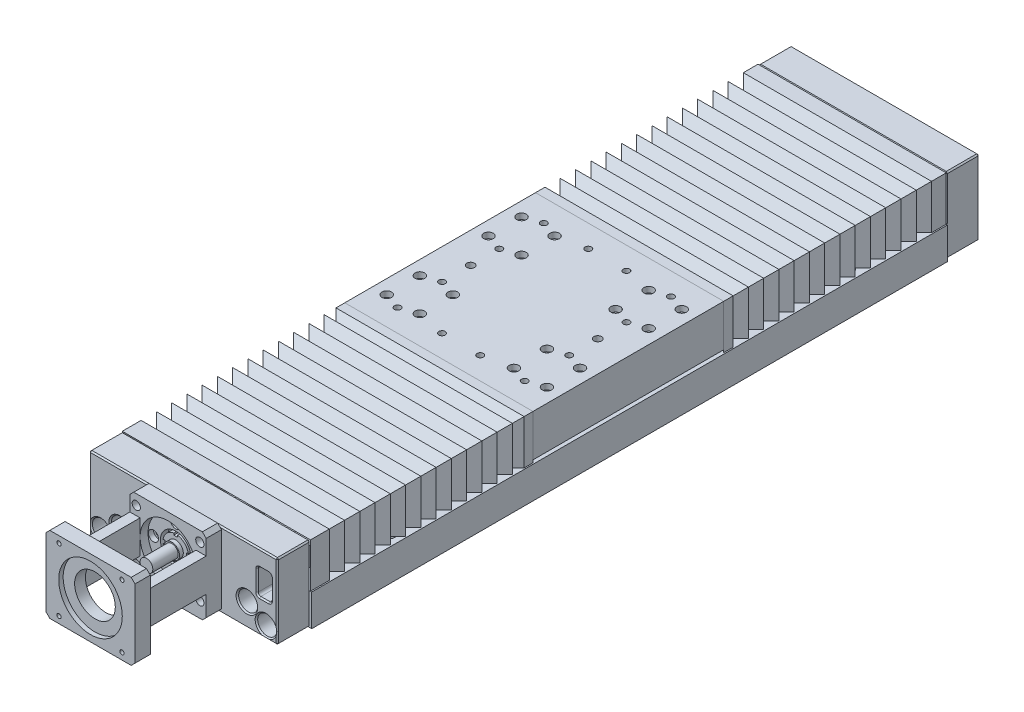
SolidWorks part; units mm, degrees
other "<AR15MN滑块>-<Ø5.0 (5) 直径孔1>" parameters "D14"=4, "D15"=4, "D23"=10, "D24"=7
ref_plane "前视基准面" through (0, 0, 0) normal (0, 0, 1) x (1, 0, 0)
ref_plane "上视基准面" through (0, 0, 0) normal (0, 1, 0) x (1, 0, 0)
ref_plane "右视基准面" through (0, 0, 0) normal (1, 0, 0) x (0, 0, -1)
sketch "草图1" plane through (0, 0, 0) normal (0, 0, 1) x (1, 0, 0)
  line L0 (37.5, 30) -> (42.5, 30)
  line L1 (-75, 0) -> (75, 0)
  line L2 (-75, 0) -> (-75, 25)
  line L3 (-42.5, 30) -> (-37.5, 30)
  line L4 (75, 0) -> (75, 25)
  line L6 (-37.5, 30) -> (-37.5, 16)
  line L7 (-34.5, 13) -> (34.5, 13)
  line L8 (37.5, 30) -> (37.5, 16)
  line L10 (-42.5, 30) -> (-42.5, 28)
  line L11 (-42.5, 28) -> (-45.5, 28)
  line L12 (42.5, 30) -> (42.5, 28)
  line L13 (42.5, 28) -> (45.5, 28)
  line L14 (-45.5, 28) -> (-45.5, 25)
  line L15 (-45.5, 25) -> (-75, 25)
  line L18 (45.5, 28) -> (45.5, 25)
  line L19 (45.5, 25) -> (75, 25)
  arc A0 (37.5, 16) -> (34.5, 13) centre (34.5, 16) cw
  arc A1 (-37.5, 16) -> (-34.5, 13) centre (-34.5, 16) ccw
  point P0 (-75, 0)
  point P3 (75, 0)
  point P12 (37.5, 13)
  point P22 (-37.5, 13)
  dimension "D11" = 3
  dimension "D1" = 150
  dimension "D2" = 13
  dimension "D3" = 75
  dimension "D4" = 85
  dimension "D5" = 91
  dimension "D6" = 30
  dimension "D7" = 75
  dimension "D9" = 25
  dimension "D10" = 28
extrude "凸台-拉伸1" add sketch "草图1" along normal mid plane 500
ref_plane "基准面1" through (0, 0, 250) normal (0, 0, 1) x (1, 0, 0)
sketch "草图3" plane through (0, 0, 250) normal (0, 0, 1) x (1, 0, 0)
  line L1 (-74, 60) -> (74, 60)
  line L2 (-74, 60) -> (-74, 1)
  line L3 (-74, 1) -> (74, 1)
  line L4 (74, 60) -> (74, 1)
  dimension "D1" = 148
  dimension "D2" = 59
  dimension "D3" = 74
  dimension "D4" = 1
extrude "凸台-拉伸2" add sketch "草图3" along normal blind 26 separate body
ref_plane "基准面2" through (0, 0, -250) normal (0, 0, -1) x (-1, 0, 0)
sketch "草图4" plane through (0, 0, -250) normal (0, 0, -1) x (-1, 0, 0)
  line L1 (-74, 1) -> (74, 1)
  line L2 (-74, 1) -> (-74, 60)
  line L3 (-74, 60) -> (74, 60)
  line L4 (74, 1) -> (74, 60)
extrude "凸台-拉伸3" add sketch "草图4" along normal blind 26
sketch "草图5" plane through (0, 0, 276) normal (0, 0, 1) x (1, 0, 0)
  circle A0 centre (0, 33) radius 10
  dimension "D1" = 20
  dimension "D2" = 33
extrude "切除-拉伸1" cut sketch "草图5" against normal up to next
sketch "草图6" plane through (0, 0, 276) normal (0, 0, 1) x (1, 0, 0)
  circle A0 centre (0, 33) radius 14
  dimension "D1" = 28
extrude "切除-拉伸2" cut sketch "草图6" against normal blind 18
sketch "草图7" plane through (0, 0, -276) normal (0, 0, -1) x (-1, 0, 0)
  circle A0 centre (0, 33) radius 13
  dimension "D2" = 26
  dimension "D1" = 33
extrude "切除-拉伸3" cut sketch "草图7" against normal up to next
sketch "草图8" plane through (0, 0, 0) normal (0, 0, 1) x (1, 0, 0)
  line L0 (-20, 44) -> (-20, 24)
  line L1 (-74, 60) -> (74, 60)
  line L2 (-74, 60) -> (-74, 27)
  line L3 (-10, 14) -> (10, 14)
  line L4 (74, 60) -> (74, 27)
  line L5 (-20, 44) -> (-33, 44)
  line L6 (20, 44) -> (20, 33)
  line L7 (-33, 44) -> (-33, 52)
  line L8 (-33, 52) -> (-67, 52)
  line L9 (-67, 52) -> (-67, 44)
  line L10 (-67, 44) -> (-69, 44)
  line L11 (-69, 44) -> (-69, 27)
  line L12 (20, 33) -> (17, 33)
  line L13 (-69, 27) -> (-74, 27)
  line L14 (20, 44) -> (33, 44)
  line L15 (17, 33) -> (17, 21)
  line L16 (33, 44) -> (33, 52)
  line L17 (33, 52) -> (67, 52)
  line L18 (67, 52) -> (67, 44)
  line L19 (67, 44) -> (69, 44)
  line L20 (69, 44) -> (69, 27)
  line L21 (69, 27) -> (74, 27)
  line L22 (-20, 24) -> (-10, 14)
  line L23 (10, 14) -> (17, 21)
  circle A0 centre (0, 33) radius 10
  point P9 (-20, 14)
  point P12 (17, 14)
  dimension "D1" = 20
  dimension "D2" = 27
  dimension "D3" = 148
  dimension "D4" = 74
  dimension "D5" = 33
  dimension "D6" = 40
  dimension "D7" = 20
  dimension "D8" = 46
  dimension "D9" = 3
  dimension "D10" = 138
  dimension "D11" = 69
  dimension "D12" = 33
  dimension "D13" = 66
  dimension "D14" = 33
  dimension "D15" = 34
  dimension "D16" = 34
  dimension "D17" = 8
  dimension "D18" = 16
  dimension "D19" = 16
  dimension "D20" = 27
extrude "凸台-拉伸4" add sketch "草图8" along normal mid plane 150 separate body
sketch "草图9" plane through (0, 0, -75) normal (0, 0, -1) x (-1, 0, 0)
  line L1 (-33, 44) -> (30.2224, 44)
  line L2 (-33, 44) -> (-33, 7.4314)
  line L3 (-33, 7.4314) -> (30.2224, 7.4314)
  line L4 (30.2224, 44) -> (30.2224, 7.4314)
extrude "切除-拉伸4" cut sketch "草图9" against normal blind 60
sketch "草图10" plane through (0, 0, 75) normal (0, 0, 1) x (1, 0, 0)
  circle A0 centre (0, 33) radius 14
  dimension "D1" = 28
extrude "切除-拉伸5" cut sketch "草图10" against normal blind 50
hole_wizard "M6 螺纹孔1" positions "草图12" profile "草图11" tap size "M6" standard "GB"
sketch "草图12" plane through (0, 60, 0) normal (0, 1, 0) x (-1, 0, 0)
  point P0 (50, -57.5)
  point P1 (15, -57.5)
  point P3 (-15, -57.5)
  point P5 (-50, -57.5)
  point P7 (50, -22.5)
  point P9 (50, 22.5)
  point P11 (50, 57.5)
  point P17 (15, 57.5)
  point P23 (-15, 57.5)
  point P25 (-50, -22.5)
  point P27 (-50, 22.5)
  point P29 (-50, 57.5)
  dimension "D1" = 45
  dimension "D2" = 35
  dimension "D3" = 35
  dimension "D4" = 22.5
  dimension "D5" = 30
  dimension "D6" = 35
  dimension "D7" = 35
  dimension "D8" = 15
sketch "草图11" plane through (-50, 60, -57.5) normal (1, 0, 0) x (0, 0, 1)
  line L0 (0, 0) -> (0, 12.5022)
  line L1 (0, 12.5022) -> (2.5, 11)
  line L2 (2.5, 11) -> (2.5, 0)
  line L5 (2.5, 0) -> (0, 0)
  line L10 (0, 12.5022) -> (-2.5, 11) construction
  line L11 (0, -6.35) -> (0, 107.95) construction
  dimension "螺纹孔钻头直径" = 5
  dimension "螺纹孔钻头深度" = 11
  dimension "导头角度" = 118
hole_wizard "孔1" positions "草图15" profile "草图14" legacy
sketch "草图15" plane through (0, 60, 0) normal (0, 1, 0) x (-1, 0, 0)
  point P0 (-63, -53)
  point P1 (-63, -27)
  point P3 (-37, -53)
  point P5 (-37, -27)
  point P7 (-63, 27)
  point P9 (-63, 53)
  point P11 (-37, 27)
  point P13 (-37, 53)
  point P15 (63, 53)
  point P17 (63, 27)
  point P19 (37, 27)
  point P21 (37, 53)
  point P23 (63, -27)
  point P25 (63, -53)
  point P27 (37, -53)
  point P29 (37, -27)
  dimension "D1" = 26
  dimension "D2" = 26
  dimension "D3" = 26
  dimension "D4" = 26
  dimension "D5" = 54
  dimension "D6" = 27
  dimension "D7" = 74
  dimension "D8" = 37
sketch "草图14" plane through (63, 60, -53) normal (1, 0, 0) x (0, 0, 1)
  line L0 (0, 0) -> (0, 100)
  line L1 (0, 100) -> (2.25, 100)
  line L2 (2.25, 100) -> (2.25, 4.5)
  line L3 (2.25, 4.5) -> (3.75, 4.5)
  line L4 (3.75, 4.5) -> (3.75, 0)
  line L5 (3.75, 0) -> (0, 0)
  line L6 (0, 110) -> (0, -10) construction
  dimension "直径" = 4.5
  dimension "深度" = 100
  dimension "柱坑直径" = 7.5
  dimension "柱坑深度" = 4.5
ref_plane "基准面3" through (0, 33, 0) normal (0, 1, 0) x (-1, 0, 0)
sketch "草图17" plane through (0, 0, 276) normal (0, 0, 1) x (1, 0, 0)
  line L0 (58, 37) -> (69, 37) construction
  line L1 (60, 47) -> (67, 47)
  line L2 (58, 45) -> (58, 29)
  line L3 (60, 27) -> (67, 27)
  line L4 (69, 45) -> (69, 29)
  line L5 (-74, 1) -> (74, 1) construction
  line L6 (63.5, 47) -> (63.5, 27) construction
  arc A0 (69, 29) -> (67, 27) centre (67, 29) cw
  arc A1 (60, 27) -> (58, 29) centre (60, 29) cw
  arc A2 (58, 45) -> (60, 47) centre (60, 45) cw
  arc A3 (67, 47) -> (69, 45) centre (67, 45) cw
  point P14 (69, 27)
  point P17 (58, 27)
  point P22 (69, 47)
  dimension "D5" = 2
  dimension "D1" = 11
  dimension "D2" = 20
  dimension "D3" = 36
  dimension "D4" = 63.5
extrude "切除-拉伸6" cut sketch "草图17" against normal up to next
sketch "草图18" plane through (0, 0, 250) normal (0, 0, -1) x (-1, 0, 0)
  line L0 (-74, 1) -> (-74, 60) construction
  line L1 (-67, 47) -> (-34.5, 47)
  line L2 (-69, 45) -> (-69, 29)
  line L3 (-67, 27) -> (-34.5, 27)
  line L4 (-32.5, 45) -> (-32.5, 29)
  line L5 (-74, 60) -> (74, 60) construction
  arc A0 (-67, 27) -> (-69, 29) centre (-67, 29) cw
  arc A1 (-67, 47) -> (-69, 45) centre (-67, 45) ccw
  arc A2 (-34.5, 27) -> (-32.5, 29) centre (-34.5, 29) ccw
  arc A3 (-32.5, 45) -> (-34.5, 47) centre (-34.5, 45) ccw
  point P10 (-69, 27)
  point P13 (-69, 47)
  point P18 (-32.5, 47)
  dimension "D5" = 2
  dimension "D6" = 2
  dimension "D1" = 20
  dimension "D2" = 5
  dimension "D3" = 13
  dimension "D4" = 36.5
extrude "切除-拉伸7" cut sketch "草图18" against normal blind 10
hole_wizard "M6 螺纹孔2" positions "草图20" profile "草图19" tap size "M6" standard "GB"
sketch "草图20" plane through (0, 0, 276) normal (0, 0, 1) x (1, 0, 0)
  line L0 (-74, 1) -> (74, 1) construction
  point P0 (-25, 53)
  point P1 (25, 53)
  point P3 (-25, 13)
  point P5 (25, 13)
  dimension "D1" = 40
  dimension "D2" = 50
  dimension "D3" = 25
  dimension "D4" = 52
sketch "草图19" plane through (-25, 53, 276) normal (1, 0, 0) x (0, -1, 0)
  line L0 (0, 0) -> (0, 16.5022)
  line L1 (0, 16.5022) -> (2.5, 15)
  line L2 (2.5, 15) -> (2.5, 0)
  line L5 (2.5, 0) -> (0, 0)
  line L10 (0, 16.5022) -> (-2.5, 15) construction
  line L11 (0, -6.35) -> (0, 107.95) construction
  dimension "螺纹孔钻头直径" = 5
  dimension "螺纹孔钻头深度" = 15
  dimension "导头角度" = 118
chamfer "倒角1" distance 1 angle 45 12 edges at (0, 1, 250) (74, 30.5, 250) (74, 1, 263) (0, 1, 276) (74, 30.5, 276) (74, 60, 263) (0, 60, 250) (-74, 1, 263) (-74, 30.5, 250) (-74, 30.5, 276) (-74, 60, 263) (0, 60, 276)
hole_wizard "孔2" positions "草图23" profile "草图22" legacy
sketch "草图23" plane through (0, 0, 276) normal (0, 0, 1) x (1, 0, 0)
  line L0 (73, 1) -> (-73, 1) construction
  point P0 (-65, 10)
  point P1 (-50, 19)
  point P3 (50, 19)
  point P5 (65, 10)
  dimension "D1" = 130
  dimension "D2" = 65
  dimension "D3" = 100
  dimension "D4" = 50
  dimension "D5" = 9
  dimension "D6" = 18
sketch "草图22" plane through (-65, 10, 276) normal (1, 0, 0) x (0, -1, 0)
  line L0 (0, 0) -> (0, 100)
  line L1 (0, 100) -> (4.5, 100)
  line L2 (4.5, 100) -> (4.5, 16)
  line L3 (4.5, 16) -> (7.5, 16)
  line L4 (7.5, 16) -> (7.5, 0)
  line L5 (7.5, 0) -> (0, 0)
  line L6 (0, 110) -> (0, -10) construction
  dimension "直径" = 9
  dimension "深度" = 100
  dimension "柱坑直径" = 15
  dimension "柱坑深度" = 16
hole_wizard "孔3" positions "草图26" profile "草图25" legacy
sketch "草图26" plane through (0, 0, -276) normal (0, 0, -1) x (-1, 0, 0)
  line L0 (-74, 1) -> (74, 1) construction
  point P0 (-65, 10)
  point P1 (-50, 19)
  point P3 (65, 10)
  point P5 (50, 19)
  dimension "D1" = 100
  dimension "D2" = 130
  dimension "D3" = 50
  dimension "D4" = 65
  dimension "D5" = 9
  dimension "D6" = 18
sketch "草图25" plane through (65, 10, -276) normal (1, 0, 0) x (0, 1, 0)
  line L0 (0, 0) -> (0, 100)
  line L1 (0, 100) -> (4.5, 100)
  line L2 (4.5, 100) -> (4.5, 16)
  line L3 (4.5, 16) -> (7.5, 16)
  line L4 (7.5, 16) -> (7.5, 0)
  line L5 (7.5, 0) -> (0, 0)
  line L6 (0, 110) -> (0, -10) construction
  dimension "直径" = 9
  dimension "深度" = 100
  dimension "柱坑直径" = 15
  dimension "柱坑深度" = 16
sketch "草图28" plane through (0, 0, 276) normal (0, 0, 1) x (1, 0, 0)
  line L0 (82.5, 33) -> (-82.5, 33) construction
  line L1 (-30, 61) -> (30, 61)
  line L2 (-30, 61) -> (-30, 1)
  line L3 (-30, 1) -> (30, 1)
  line L4 (30, 61) -> (30, 1)
  circle A0 centre (0, 33) radius 22
  circle A1 centre (-25, 53) radius 3.25
  circle A2 centre (25, 53) radius 3.25
  circle A3 centre (25, 13) radius 3.25
  circle A4 centre (-25, 13) radius 3.25
  dimension "D5" = 44
  dimension "D6" = 6.5
  dimension "D1" = 60
  dimension "D2" = 60
  dimension "D3" = 28
  dimension "D4" = 30
extrude "凸台-拉伸5" add sketch "草图28" along normal blind 12
sketch "草图29" plane through (0, 0, 288) normal (0, 0, 1) x (1, 0, 0)
  line L0 (-30, 59) -> (-30, 2) construction
  line L1 (-30, 46) -> (-22, 46)
  line L2 (-30, 46) -> (-30, 20)
  line L3 (-30, 20) -> (-22, 20)
  line L4 (-22, 46) -> (-22, 20)
  line L5 (30, 1) -> (30, 61) construction
  line L6 (30, 46) -> (22, 46)
  line L7 (30, 46) -> (30, 20)
  line L8 (30, 20) -> (22, 20)
  line L9 (22, 46) -> (22, 20)
  line L10 (82.5, 33) -> (-82.5, 33) construction
  dimension "D1" = 26
  dimension "D2" = 13
  dimension "D3" = 8
  dimension "D4" = 8
extrude "凸台-拉伸6" add sketch "草图29" along normal blind 49
sketch "草图30" plane through (0, 0, 337) normal (0, 0, 1) x (1, 0, 0)
  line L0 (82.5, 33) -> (-82.5, 33) construction
  line L1 (-35, 63) -> (35, 63)
  line L2 (-35, 63) -> (-35, 3)
  line L3 (-35, 3) -> (35, 3)
  line L4 (35, 63) -> (35, 3)
  circle A0 centre (0, 33) radius 16
  dimension "D5" = 32
  dimension "D1" = 60
  dimension "D2" = 30
  dimension "D3" = 70
  dimension "D4" = 35
extrude "凸台-拉伸7" add sketch "草图30" along normal blind 12
hole_wizard "M4 螺纹孔1" positions "草图32" profile "草图31" tap size "M4" standard "Gb"
sketch "草图32" plane through (0, 0, 349) normal (0, 0, 1) x (1, 0, 0)
  line L1 (0, 17) -> (0, 33) construction
  line L2 (0, 33) -> (16, 33) construction
  line L3 (0, 33) -> (24.7487, 57.7487) construction
  circle A0 centre (0, 33) radius 16 construction
  point P5 (24.7487, 57.7487)
  point P33 (24.7487, 8.2513)
  point P34 (-24.7487, 8.2513)
  point P35 (-24.7487, 57.7487)
  point P36 (0, 33)
  dimension "D1" = 35
  dimension "D2" = 45
  dimension "D3" = 4
sketch "草图31" plane through (24.7487, 57.7487, 349) normal (1, 0, 0) x (0, -1, 0)
  line L0 (0, 0) -> (0, 15.0914)
  line L1 (0, 15.0914) -> (1.65, 14.1)
  line L2 (1.65, 14.1) -> (1.65, 0)
  line L5 (1.65, 0) -> (0, 0)
  line L10 (0, 15.0914) -> (-1.65, 14.1) construction
  line L11 (0, -6.35) -> (0, 107.95) construction
  dimension "螺纹孔钻头直径" = 3.3
  dimension "螺纹孔钻头深度" = 14.1
  dimension "导头角度" = 118
sketch "草图33" plane through (0, 0, 349) normal (0, 0, 1) x (1, 0, 0)
  circle A0 centre (0, 33) radius 25
  dimension "D1" = 50
extrude "切除-拉伸8" cut sketch "草图33" against normal blind 3.5
sketch "草图34" plane through (0, 0, 0) normal (0, 0, 1) x (1, 0, 0)
  line L0 (0, 0) -> (0, 97.129) construction
  line L1 (-42.5, 25) -> (-57.5, 25)
  line L2 (-42.5, 25) -> (-42.5, 40)
  line L3 (-42.5, 40) -> (-57.5, 40)
  line L4 (-57.5, 25) -> (-57.5, 40)
  line L5 (42.5, 25) -> (57.5, 25)
  line L6 (42.5, 25) -> (42.5, 40)
  line L7 (42.5, 40) -> (57.5, 40)
  line L8 (57.5, 25) -> (57.5, 40)
  dimension "D1" = 15
  dimension "D2" = 15
  dimension "D3" = 15
  dimension "D4" = 85
extrude "凸台-拉伸8" add sketch "草图34" against normal up to surface (250 mm away) separate body
mirror "镜向2" about plane through (0, 0, 0) normal (0, 0, 1) of "凸台-拉伸8"
sketch "草图39" plane through (0, 33, 0) normal (0, 1, 0) x (-1, 0, 0)
  line L0 (0, 305.5936) -> (0, -249.1557) construction
  line L1 (8, 258) -> (8, -252)
  line L2 (8, -252) -> (5, -252)
  line L3 (5, -252) -> (5, -279)
  line L4 (5, -279) -> (0, -279)
  line L5 (8, 258) -> (6, 258)
  line L6 (6, 258) -> (6, 285)
  line L7 (5, 305) -> (0, 305)
  line L8 (-75, -250) -> (-74, -250) construction
  line L9 (33.005, 250) -> (-33.005, 250) construction
  line L10 (0, 305) -> (0, -279)
  line L12 (5, 305) -> (5, 285)
  line L13 (5, 285) -> (6, 285)
  dimension "D1" = 8
  dimension "D2" = 47
  dimension "D3" = 5
  dimension "D4" = 2
  dimension "D5" = 8
  dimension "D6" = 6
  dimension "D7" = 27
  dimension "D8" = 5
  dimension "D9" = 27
revolve "旋转1" add sketch "草图39" angle 360 about L0
sketch "草图40" plane through (0, 0, 276) normal (0, 0, 1) x (1, 0, 0)
  circle A0 centre (0, 33) radius 21.75
  circle A1 centre (0, 33) radius 12
  dimension "D1" = 43.5
  dimension "D2" = 24
extrude "凸台-拉伸11" add sketch "草图40" along normal blind 6
hole_wizard "孔4" positions "草图42" profile "草图41" legacy
sketch "草图42" plane through (0, 0, 282) normal (0, 0, 1) x (1, 0, 0)
  circle A0 centre (0, 33) radius 17.5 construction
  point P0 (-17.5, 33)
  point P6 (0, 50.5)
  point P8 (17.5, 33)
  point P10 (0, 15.5)
  dimension "D1" = 35
sketch "草图41" plane through (-17.5, 33, 282) normal (1, 0, 0) x (0, -1, 0)
  line L0 (0, 0) -> (0, 6)
  line L1 (0, 6) -> (2.25, 6)
  line L2 (2.25, 6) -> (2.25, 4)
  line L3 (2.25, 4) -> (4, 4)
  line L4 (4, 4) -> (4, 0)
  line L5 (4, 0) -> (0, 0)
  line L6 (0, 110) -> (0, -10) construction
  dimension "直径" = 4.5
  dimension "深度" = 6
  dimension "柱坑直径" = 8
  dimension "柱坑深度" = 4
sketch "草图43" plane through (0, 0, 282) normal (0, 0, 1) x (1, 0, 0)
  line L0 (82.5, 33) -> (-82.5, 33) construction
  line L2 (-1.5, 42.8869) -> (-1.5, 41.5)
  line L3 (-1.5, 41.5) -> (1.5, 41.5)
  line L4 (1.5, 42.8869) -> (1.5, 41.5)
  line L7 (-9.8869, 34.5) -> (-8.5, 34.5)
  line L9 (-9.8869, 31.5) -> (-8.5, 31.5)
  line L10 (-8.5, 34.5) -> (-8.5, 31.5)
  line L11 (8.5, 34.5) -> (9.8869, 34.5)
  line L12 (8.5, 34.5) -> (8.5, 31.5)
  line L13 (8.5, 31.5) -> (9.8869, 31.5)
  line L15 (-1.5, 24.5) -> (1.5, 24.5)
  line L16 (-1.5, 24.5) -> (-1.5, 23.1131)
  line L18 (1.5, 24.5) -> (1.5, 23.1131)
  arc A0 (-1.5, 42.8869) -> (-9.8869, 34.5) centre (0, 33) ccw
  arc A1 (1.5, 23.1131) -> (9.8869, 31.5) centre (0, 33) ccw
  arc A2 (-9.8869, 31.5) -> (-1.5, 23.1131) centre (0, 33) ccw
  arc A3 (9.8869, 34.5) -> (1.5, 42.8869) centre (0, 33) ccw
  circle A4 centre (0, 33) radius 6
  dimension "D1" = 20
  dimension "D2" = 8.5
  dimension "D4" = 1.5
  dimension "D5" = 8.5
  dimension "D6" = 1.5
  dimension "D7" = 1.5
  dimension "D8" = 17
  dimension "D9" = 8.5
  dimension "D10" = 1.5
extrude "凸台-拉伸12" add sketch "草图43" against normal blind 8
chamfer "倒角2" distance 1 angle 45 12 edges at (0, 1, -276) (74, 1, -263) (74, 30.5, -276) (74, 60, -263) (-74, 1, -263) (0, 60, -276) (-74, 60, -263) (-74, 30.5, -276) (13, 33, -250) (-74, 42.5, -250) (0, 60, -250) (74, 42.5, -250)
sketch "草图44" plane through (0, 0, 250) normal (0, 0, 1) x (1, 0, 0)
  line L0 (-30, 1) -> (30, 1) construction
  line L1 (-30, -3.1097) -> (30, -3.1097)
  line L2 (-30, -3.1097) -> (-30, 1)
  line L3 (-30, 1) -> (30, 1)
  line L4 (30, -3.1097) -> (30, 1)
  line L5 (0, 0) -> (0, -3.1097) construction
  dimension "D1" = 60
extrude "切除-拉伸11" [suppressed] cut sketch "草图44" against normal through all
hole_wizard "打孔尺寸根据内六角圆柱头螺钉的类型1" positions "草图46" profile "草图45" counterbore size "M6" standard "Gb"
sketch "草图46" plane through (0, 25, 0) normal (0, 1, 0) x (-1, 0, 0)
  line L0 (-73, 250) -> (-57.5, 250) construction
  line L1 (0, 427.1114) -> (0, 344.81) construction
  point P0 (-65, 180)
  point P2 (65, 180)
  dimension "D1" = 70
  dimension "D2" = 130
sketch "草图45" plane through (65, 25, 180) normal (1, 0, 0) x (0, 0, 1)
  line L0 (0, 0) -> (0, 25)
  line L1 (0, 25) -> (3.3, 25)
  line L3 (3.3, 25) -> (3.3, 9)
  line L4 (3.3, 9) -> (5.5, 9)
  line L5 (5.5, 9) -> (5.5, 0)
  line L7 (5.5, 0) -> (0, 0)
  line L11 (0, -6.35) -> (0, 107.95) construction
  dimension "Í¨¿×¿×Ö±¾¶" = 6.6
  dimension "Í¨¿×¿×Éî¶È" = 25
  dimension "ÖùÐÎ³ÁÍ·¿×Ö±¾¶" = 11
  dimension "ÖùÐÎ³ÁÍ·¿×Éî¶È" = 9
pattern_linear "阵列(线性)2" count 4 spacing 120 along (0, 0, -1) of "打孔尺寸根据内六角圆柱头螺钉的类型1"
hole_wizard "Ø6.0 (6) 直径孔1" positions "草图50" profile "草图49" hole size "Ø6.0" standard "Gb"
sketch "草图50" plane through (0, 60, 0) normal (0, 1, 0) x (1, 0, 0)
  line L0 (0, -75) -> (0, 0) construction
  line L1 (74, -75) -> (-74, -75) construction
  line L2 (0, 0) -> (74, 0) construction
  line L3 (74, -75) -> (74, 75) construction
  point P0 (-50, 0)
  point P2 (50, 0)
  dimension "D1" = 100
sketch "草图49" plane through (-50, 60, 0) normal (1, 0, 0) x (0, 0, 1)
  line L0 (0, 0) -> (0, 10)
  line L1 (0, 10) -> (3, 10)
  line L2 (3, 10) -> (3, 0)
  line L5 (3, 0) -> (0, 0)
  line L10 (0, 10) -> (-3, 10) construction
  line L11 (0, -6.35) -> (0, 107.95) construction
  dimension "¿×Ö±¾¶" = 6
  dimension "¿×Éî¶È" = 10
  dimension "µ¼Í·½Ç¶È" = 180
inserted part "AR15MN滑块"
move or copy body "实体-移动/复制4" placed by mates yes
hole_wizard "M4 六角头螺栓的柱形沉头孔1" positions "草图53" profile "草图52" counterbore size "M4" standard "Gb"
sketch "草图53" plane through (0, 40, 0) normal (0, 1, 0) x (1, 0, 0)
  line L0 (-50, 250) -> (-50, 403.053) construction
  line L1 (-57.5, 250) -> (-42.5, 250) construction
  line L3 (-73, 250) -> (73, 250) construction
  line L4 (0, 250) -> (0, 420) construction
  point P0 (-50, 210)
  point P17 (50, 210)
  dimension "D1" = 40
sketch "草图52" plane through (-50, 40, -210) normal (1, 0, 0) x (0, 0, 1)
  line L0 (0, 0) -> (0, 40)
  line L1 (0, 40) -> (2.25, 40)
  line L3 (2.25, 40) -> (2.25, 4.6)
  line L4 (2.25, 4.6) -> (4, 4.6)
  line L5 (4, 4.6) -> (4, 0)
  line L7 (4, 0) -> (0, 0)
  line L11 (0, -6.35) -> (0, 107.95) construction
  dimension "通孔孔直径" = 4.5
  dimension "通孔孔深度" = 40
  dimension "柱形沉头孔直径" = 8
  dimension "柱形沉头孔深度" = 4.6
pattern_linear "阵列(线性)3" count 8 spacing 60 along (0, 0, 1) of "M4 六角头螺栓的柱形沉头孔1"
sketch "草图54" plane through (0, 0, 0) normal (0, -1, 0) x (1, 0, 0)
  line L0 (-75, 250) -> (75, 250) construction
  line L1 (-42.5, 250) -> (42.5, 250)
  line L2 (-42.5, 250) -> (-42.5, -250)
  line L3 (-42.5, -250) -> (42.5, -250)
  line L4 (42.5, 250) -> (42.5, -250)
  line L5 (-75, -250) -> (75, -250) construction
  line L6 (0, -275) -> (0, -232.2183) construction
  line L7 (-73, -275) -> (73, -275) construction
  dimension "D1" = 85
extrude "切除-拉伸12" cut sketch "草图54" against normal blind 0.5
sketch "草图55" plane through (0, 0, -276) normal (0, 0, -1) x (-1, 0, 0)
  line L0 (-59.75, 53) -> (-50.25, 53) construction
  line L1 (-59.75, 55.25) -> (-50.25, 55.25)
  line L2 (-59.75, 50.75) -> (-50.25, 50.75)
  line L3 (0, 59) -> (0, 11.3473) construction
  line L4 (73, 59) -> (-73, 59) construction
  line L5 (73, 1) -> (-73, 1) construction
  line L6 (59.75, 53) -> (50.25, 53) construction
  line L7 (59.75, 55.25) -> (50.25, 55.25)
  line L8 (59.75, 50.75) -> (50.25, 50.75)
  arc A0 (-59.75, 55.25) -> (-59.75, 50.75) centre (-59.75, 53) ccw
  arc A1 (-50.25, 50.75) -> (-50.25, 55.25) centre (-50.25, 53) ccw
  arc A2 (59.75, 55.25) -> (59.75, 50.75) centre (59.75, 53) cw
  arc A3 (50.25, 50.75) -> (50.25, 55.25) centre (50.25, 53) cw
  point P2 (-55, 53)
  point P17 (55, 53)
  dimension "D2" = 2.25
  dimension "D1" = 9.5
  dimension "D3" = 55
  dimension "D4" = 52
extrude "切除-拉伸13" cut sketch "草图55" against normal blind 45.5
sketch "草图56" plane through (0, 0, -276) normal (0, 0, -1) x (-1, 0, 0)
  line L0 (-59.75, 53) -> (-50.25, 53) construction
  line L1 (-59.75, 57) -> (-50.25, 57)
  line L2 (-59.75, 49) -> (-50.25, 49)
  line L3 (50.25, 53) -> (59.75, 53) construction
  line L4 (50.25, 57) -> (59.75, 57)
  line L5 (50.25, 49) -> (59.75, 49)
  arc A0 (-59.75, 57) -> (-59.75, 49) centre (-59.75, 53) ccw
  arc A1 (-50.25, 49) -> (-50.25, 57) centre (-50.25, 53) ccw
  arc A2 (50.25, 57) -> (50.25, 49) centre (50.25, 53) ccw
  arc A3 (59.75, 49) -> (59.75, 57) centre (59.75, 53) ccw
  point P4 (-55, 53)
  point P9 (55, 53)
  dimension "D1" = 4
extrude "切除-拉伸14" cut sketch "草图56" against normal blind 16
chamfer "倒角3" distance 1 angle 45 13 edges at (-72.5, 10, -276) (-57.5, 19, -276) (-63.75, 53, -276) (-55, 57, -276) (-46.25, 53, -276) (-55, 49, -276) (-13, 33, -276) (57.5, 10, -276) (42.5, 19, -276) (63.75, 53, -276) (55, 49, -276) (55, 57, -276) (46.25, 53, -276)
chamfer "倒角4" distance 1 angle 45 12 edges at (58.5858, 27.5858, 276) (58, 37, 276) (58.5858, 46.4142, 276) (63.5, 47, 276) (68.4142, 46.4142, 276) (69, 37, 276) (68.4142, 27.5858, 276) (63.5, 27, 276) (72.5, 10, 276) (57.5, 19, 276) (-57.5, 10, 276) (-42.5, 19, 276)
sketch "草图57" plane through (0, 0, 250) normal (0, 0, -1) x (-1, 0, 0)
  line L0 (0, 59) -> (0, 49.44) construction
  line L1 (73, 59) -> (-73, 59) construction
  line L2 (73, 1) -> (-73, 1) construction
  circle A0 centre (-40, 53) radius 5
  circle A1 centre (40, 53) radius 5
  dimension "D1" = 10
  dimension "D2" = 52
  dimension "D3" = 80
extrude "切除-拉伸15" cut sketch "草图57" against normal blind 8
sketch "草图58" plane through (0, 0, -250) normal (0, 0, 1) x (1, 0, 0)
  line L0 (0, 59) -> (0, 47) construction
  line L1 (73, 59) -> (-73, 59) construction
  line L2 (-75, 0) -> (-42.5, 0) construction
  circle A0 centre (-40, 52) radius 5
  circle A1 centre (40, 52) radius 5
  circle A2 centre (0, 33) radius 14 construction
  dimension "D3" = 10
  dimension "D1" = 80
  dimension "D2" = 52
extrude "切除-拉伸16" cut sketch "草图58" against normal blind 8
sketch "草图60" plane through (0, 0, -250) normal (0, 0, 1) x (1, 0, 0)
  line L0 (-74, 25) -> (-74, 60)
  line L1 (-74, 60) -> (74, 60)
  line L2 (74, 60) -> (74, 25)
  line L3 (-73, 60) -> (73, 60) construction
  line L4 (-74, 25) -> (-74, 59) construction
  line L5 (-57.5, 25) -> (-73, 25) construction
  line L6 (74, 59) -> (74, 25) construction
  line L7 (73, 25) -> (57.5, 25) construction
sketch "草图61" plane through (0, 25, 0) normal (0, 1, 0) x (1, 0, 0)
  line L0 (74, 250) -> (74, 238.4429)
  line L1 (74, 238.4429) -> (68, 232.4429)
  line L2 (68, 232.4429) -> (74, 226.4429)
  line L3 (68, 232.4429) -> (75, 232.4429) construction
  line L4 (75, -250) -> (75, 250) construction
  line L5 (68, 220.4429) -> (74, 214.4429)
  line L6 (74, 226.4429) -> (68, 220.4429)
  line L7 (68, 208.4429) -> (74, 202.4429)
  line L8 (74, 214.4429) -> (68, 208.4429)
  line L9 (68, 196.4429) -> (74, 190.4429)
  line L10 (74, 202.4429) -> (68, 196.4429)
  line L11 (68, 184.4429) -> (74, 178.4429)
  line L12 (74, 190.4429) -> (68, 184.4429)
  line L13 (68, 172.4429) -> (74, 166.4429)
  line L14 (74, 178.4429) -> (68, 172.4429)
  line L15 (68, 160.4429) -> (74, 154.4429)
  line L16 (74, 166.4429) -> (68, 160.4429)
  line L17 (68, 148.4429) -> (74, 142.4429)
  line L18 (74, 154.4429) -> (68, 148.4429)
  line L19 (68, 136.4429) -> (74, 130.4429)
  line L20 (74, 142.4429) -> (68, 136.4429)
  line L21 (68, 124.4429) -> (74, 118.4429)
  line L22 (74, 130.4429) -> (68, 124.4429)
  line L23 (68, 112.4429) -> (74, 106.4429)
  line L24 (74, 118.4429) -> (68, 112.4429)
  line L25 (68, 100.4429) -> (74, 94.4429)
  line L26 (74, 106.4429) -> (68, 100.4429)
  line L27 (68, 88.4429) -> (74, 82.4429)
  line L28 (74, 94.4429) -> (68, 88.4429)
  line L29 (74, 82.4429) -> (74, 75)
  dimension "D1" = 90
  dimension "D3" = 12
surface "曲面-扫描1"
sketch "草图62" plane through (0, 0, 250) normal (0, 0, -1) x (-1, 0, 0)
  line L0 (-74, 25) -> (-74, 60)
  line L1 (-74, 60) -> (74, 60)
  line L2 (74, 60) -> (74, 25)
  line L3 (74, 59) -> (74, 2) construction
  line L4 (-73, 60) -> (73, 60) construction
  line L5 (-74, 2) -> (-74, 59) construction
  line L6 (-73, 25) -> (-57.5, 25) construction
  line L7 (57.5, 25) -> (73, 25) construction
sketch "草图63" plane through (0, 25, 0) normal (0, 1, 0) x (1, 0, 0)
  line L0 (-74, -250) -> (-74, -235.2101)
  line L1 (74, -250) -> (-74, -250) construction
  line L2 (-74, -235.2101) -> (-68, -229.2101)
  line L3 (-68, -229.2101) -> (-74, -223.2101)
  line L4 (-68, -229.2101) -> (-75, -229.2101) construction
  line L5 (-75, -250) -> (-75, 250) construction
  line L6 (-74, -223.2101) -> (-68, -217.2101)
  line L7 (-68, -217.2101) -> (-74, -211.2101)
  line L8 (-74, -211.2101) -> (-68, -205.2101)
  line L9 (-68, -205.2101) -> (-74, -199.2101)
  line L10 (-74, -199.2101) -> (-68, -193.2101)
  line L11 (-68, -193.2101) -> (-74, -187.2101)
  line L12 (-74, -187.2101) -> (-68, -181.2101)
  line L13 (-68, -181.2101) -> (-74, -175.2101)
  line L14 (-74, -175.2101) -> (-68, -169.2101)
  line L15 (-68, -169.2101) -> (-74, -163.2101)
  line L16 (-74, -163.2101) -> (-68, -157.2101)
  line L17 (-68, -157.2101) -> (-74, -151.2101)
  line L18 (-74, -151.2101) -> (-68, -145.2101)
  line L19 (-68, -145.2101) -> (-74, -139.2101)
  line L20 (-74, -139.2101) -> (-68, -133.2101)
  line L21 (-68, -133.2101) -> (-74, -127.2101)
  line L22 (-74, -127.2101) -> (-68, -121.2101)
  line L24 (-68, -121.2101) -> (-74, -115.2101)
  line L25 (-74, -115.2101) -> (-68, -109.2101)
  line L26 (-68, -109.2101) -> (-74, -103.2101)
  line L27 (-74, -103.2101) -> (-68, -97.2101)
  line L28 (-68, -97.2101) -> (-74, -91.2101)
  line L30 (-74, -91.2101) -> (-69.3699, -86.58)
  line L31 (-69.3699, -86.58) -> (-74, -81.9498)
  line L32 (-74, -75) -> (-74, -81.9498)
  dimension "D1" = 90
  dimension "D2" = 12
surface "曲面-扫描2"
chamfer "倒角5" distance 3 angle 45 8 edges at (-35, 63, 343) (-35, 3, 343) (-30, 1, 282) (-30, 61, 282) (30, 61, 282) (30, 1, 282) (35, 3, 343) (35, 63, 343)
hole_wizard "M8 螺纹孔1" positions "草图65" profile "草图64" tap size "M8" standard "Gb"
sketch "草图65" plane through (0, 0, 250) normal (0, 0, 1) x (1, 0, 0)
  point P0 (-50, 19)
  point P3 (-65, 10)
  point P6 (50, 19)
  point P9 (65, 10)
sketch "草图64" plane through (-50, 19, 250) normal (1, 0, 0) x (0, -1, 0)
  line L0 (0, 0) -> (0, 21.7929)
  line L1 (0, 21.7929) -> (3.4, 19.75)
  line L2 (3.4, 19.75) -> (3.4, 0)
  line L5 (3.4, 0) -> (0, 0)
  line L10 (0, 21.7929) -> (-3.4, 19.75) construction
  line L11 (0, -6.35) -> (0, 107.95) construction
  dimension "螺纹孔钻头直径" = 6.8
  dimension "螺纹孔钻头深度" = 19.75
  dimension "导头角度" = 118
hole_wizard "M8 螺纹孔2" positions "草图67" profile "草图66" tap size "M8" standard "Gb"
sketch "草图67" plane through (0, 0, -176) normal (0, 0, -1) x (-1, 0, 0)
  point P0 (-50, 19)
  point P3 (-65, 10)
  point P6 (50, 19)
  point P9 (65, 10)
sketch "草图66" plane through (50, 19, -176) normal (1, 0, 0) x (0, 1, 0)
  line L0 (0, 0) -> (0, 21.7929)
  line L1 (0, 21.7929) -> (3.4, 19.75)
  line L2 (3.4, 19.75) -> (3.4, 0)
  line L5 (3.4, 0) -> (0, 0)
  line L10 (0, 21.7929) -> (-3.4, 19.75) construction
  line L11 (0, -6.35) -> (0, 107.95) construction
  dimension "螺纹孔钻头直径" = 6.8
  dimension "螺纹孔钻头深度" = 19.75
  dimension "导头角度" = 118
